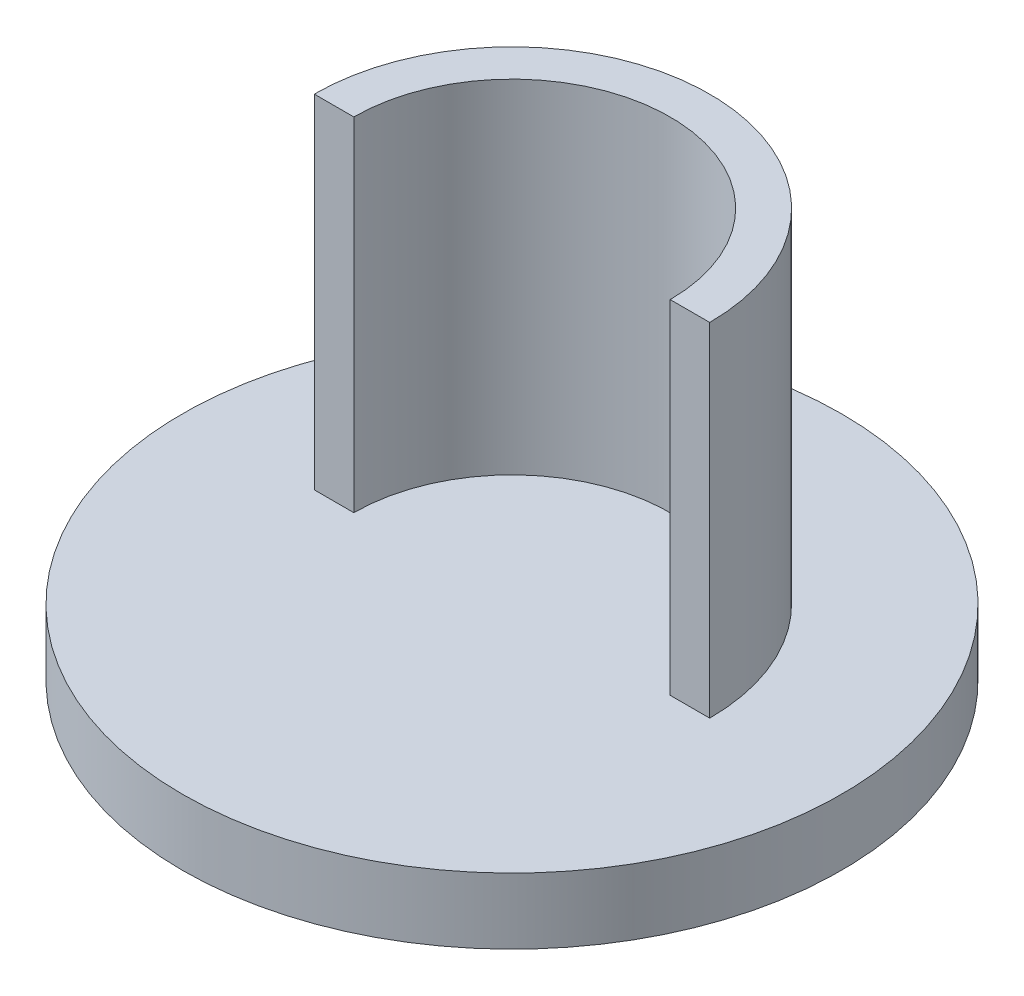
SolidWorks part; units mm, degrees
ref_plane "Front Plane" through (0, 0, 0) normal (0, 0, 1) x (1, 0, 0)
ref_plane "Top Plane" through (0, 0, 0) normal (0, 1, 0) x (1, 0, 0)
ref_plane "Right Plane" through (0, 0, 0) normal (1, 0, 0) x (0, 0, -1)
sketch "Sketch1" plane through (0, 0, 0) normal (0, 1, 0) x (1, 0, 0)
  circle A0 centre (0, 0) radius 25
  dimension "D1" = 50
extrude "Extrude1" add sketch "Sketch1" along normal blind 5
sketch "Sketch2" plane through (0, 5, 0) normal (0, 1, 0) x (-1, 0, 0)
  arc A0 (15, 0) -> (-15, 0) centre (0, 0) cw
  dimension "D1" = 15
extrude "Extrude-Thin1" add sketch "Sketch2" along normal blind 26 thin
